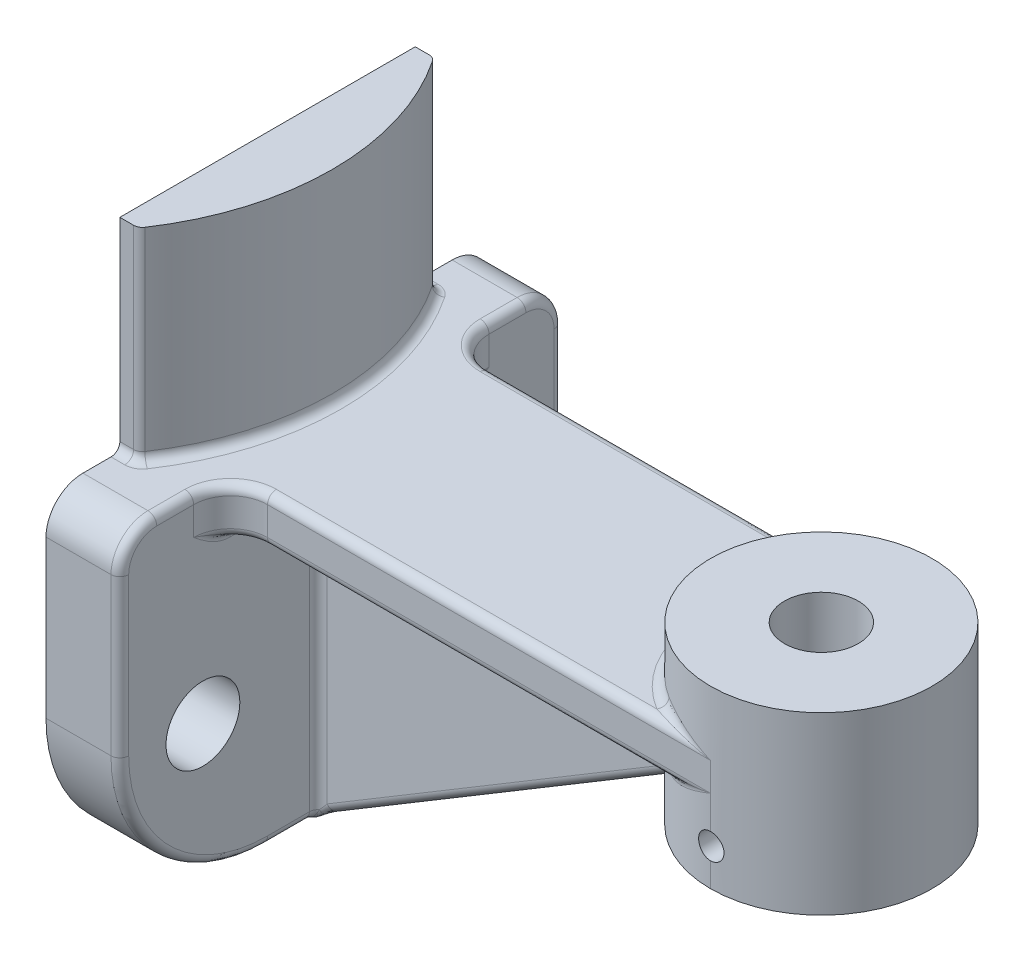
SolidWorks part; units mm, degrees
ref_plane "Front" through (0, 0, 0) normal (0, 0, 1) x (1, 0, 0)
ref_plane "Top" through (0, 0, 0) normal (0, 1, 0) x (1, 0, 0)
ref_plane "Right" through (0, 0, 0) normal (1, 0, 0) x (0, 0, -1)
sketch "Sketch1" plane through (0, 0, 0) normal (1, 0, 0) x (0, 0, -1)
  line L0 (0, 0) -> (76.2, 0)
  line L1 (0, 0) -> (0, 58.7375)
  line L2 (76.2, 58.7375) -> (0, 58.7375)
  line L3 (76.2, 58.7375) -> (76.2, 0)
  dimension "D1" = 76.2
  dimension "D2" = 58.7375
extrude "Base-Extrude" add sketch "Sketch1" along normal blind 12.7
sketch "Sketch2" plane through (12.7, 0, 0) normal (1, 0, 0) x (0, 0, -1)
  line L0 (19.05, 58.7375) -> (57.15, 58.7375)
  line L1 (19.05, 58.7375) -> (19.05, 50.8)
  line L2 (57.15, 50.8) -> (19.05, 50.8)
  line L3 (57.15, 50.8) -> (57.15, 58.7375)
  line L4 (76.2, 58.7375) -> (0, 58.7375) construction
  line L5 (38.1, 58.7375) -> (38.1, 0) construction
  line L6 (0, 0) -> (76.2, 0) construction
  dimension "D1" = 7.9375
  dimension "D2" = 38.1
extrude "Boss-Extrude3" add sketch "Sketch2" along normal offset from surface (82.55 mm away) 95.25
ref_plane "Plane4" through (0, 68.2625, 0) normal (0, 1, 0) x (-1, 0, 0)
sketch "Sketch4" plane through (0, 68.2625, 0) normal (0, 1, 0) x (-1, 0, 0)
  line L0 (-95.25, -57.15) -> (-95.25, -19.05) construction
  circle A0 centre (-95.25, -38.1) radius 19.05
extrude "Boss-Extrude4" add sketch "Sketch4" against normal blind 30.1625
sketch "Sketch5" plane through (0, 58.7375, 0) normal (0, 1, 0) x (-1, 0, 0)
  line L0 (0, -63.5) -> (-3.175, -63.5)
  line L1 (0, -63.5) -> (0, -12.7)
  line L2 (-3.175, -12.7) -> (0, -12.7)
  line L4 (0, -76.2) -> (0, 0) construction
  arc A0 (-3.175, -12.7) -> (-3.175, -63.5) centre (33.303, -38.1) ccw
  point P6 (0, -38.1)
  dimension "D3" = 44.45
  dimension "D1" = 50.8
  dimension "D2" = 3.175
extrude "Boss-Extrude5" add sketch "Sketch5" along normal blind 34.925
sketch "Sketch6" plane through (0, 0, 0) normal (1, 0, 0) x (0, 0, -1)
  line L0 (63.5, 93.6625) -> (12.7, 93.6625) construction
  line L1 (0, 0) -> (76.2, 0) construction
  point P0 (38.1, 93.6625)
  point P1 (38.1, 0)
sketch "Sketch7" plane through (0, 0, 0) normal (0, 1, 0) x (1, 0, 0)
  line L0 (12.7, 0) -> (12.7, 76.2) construction
  point P0 (12.7, 38.1)
ref_plane "Plane5" through (0, 0, -38.1) normal (0, 0, -1) x (-1, 0, 0)
sketch "Sketch8" plane through (0, 0, -38.1) normal (0, 0, -1) x (-1, 0, 0)
  line L0 (-12.7, 0) -> (-95.25, 49.53)
  line L2 (-12.7, 50.8) -> (-12.7, 0)
  line L3 (-95.25, 50.8) -> (-12.7, 50.8) construction
  line L4 (-95.25, 50.8) -> (-12.7, 50.8)
  line L5 (-95.25, 50.8) -> (-95.25, 49.53)
  line L6 (-95.25, 50.8) -> (-95.25, 58.7375) construction
  point P0 (-76.2, 38.1)
extrude "Boss-Extrude7" add sketch "Sketch8" along normal mid plane 7.9375
sketch "Sketch9" plane through (12.7, 0, 0) normal (1, 0, 0) x (0, 0, -1)
  line L0 (19.05, 58.7375) -> (0, 58.7375) construction
  line L1 (14.2875, 23.8125) -> (61.9125, 23.8125) construction
  line L2 (38.1, 23.8125) -> (38.1, 0) construction
  line L3 (42.0688, 0) -> (34.1313, 0) construction
  circle A0 centre (14.2875, 23.8125) radius 6.35
  circle A1 centre (61.9125, 23.8125) radius 6.35
  dimension "D1" = 12.7
  dimension "D2" = 34.925
  dimension "D3" = 47.625
extrude "Cut-Extrude1" cut sketch "Sketch9" against normal through all
sketch "Sketch10" plane through (0, 68.2625, 0) normal (0, 1, 0) x (-1, 0, 0)
  circle A0 centre (-95.25, -38.1) radius 6.35
  circle A1 centre (-95.25, -38.1) radius 19.05 construction
  dimension "D1" = 12.7
extrude "Cut-Extrude2" cut sketch "Sketch10" against normal through all
sketch "Sketch11" plane through (0, 0, -38.1) normal (0, 0, -1) x (-1, 0, 0)
  line L0 (-101.6, 38.1) -> (-88.9, 38.1) construction
  circle A0 centre (-95.25, 44.45) radius 2.1828
  dimension "D1" = 4.3656
  dimension "D2" = 6.35
extrude "Cut-Extrude3" cut sketch "Sketch11" against normal through all and the other way through all
fillet "Fillet1" radius 6.35 6 edges at (6.35, 58.7375, -76.2) (6.35, 58.7375, 0)
fillet "Fillet2" radius 25.4 2 edges at (6.35, 0, 0) (6.35, 0, -76.2)
fillet "Fillet4" radius 1.524 11 edges at (14.5599, 50.8, -17.1901) (14.5599, 50.8, -59.0099) (57.15, 50.8, -19.05) (57.15, 50.8, -57.15) (11.147, 58.7375, -38.1) (3.175, 76.2, -12.7) (3.175, 76.2, -63.5) (1.5875, 58.7375, -63.5) (1.5875, 58.7375, -12.7) (44.659, 50.8, -42.0688) (44.659, 50.8, -34.1313)
fillet "Fillet5" radius 1.524 14 edges at (14.5599, 58.7375, -17.1901) (14.5599, 58.7375, -59.0099) (12.7, 0, -29.7656) (12.7, 38.8937, 0) (12.7, 7.4395, -7.4395) (12.7, 7.4395, -68.7605) (12.7, 0, -46.4344) (12.7, 38.8937, -76.2) (12.7, 56.8776, -74.3401) (12.7, 56.8776, -1.8599)
fillet "Fillet6" radius 1.524 3 edges at (76.2, 58.7375, -38.1) (90.6843, 58.39, -19.6052) (90.6843, 58.39, -56.5948)
fillet "Fillet7" radius 1.524 12 edges at (12.7, 50.8, -24.9816) (12.7, 50.8, -51.2184) (12.7, 25.4, -42.0688) (12.7, 50.3536, -42.5151) (12.7, 25.4, -34.1313) (12.7, 50.3536, -33.6849) (12.7, 51.1454, -15.4195) (12.7, 51.1454, -60.7805) (11.938, 0, -42.0688) (11.938, 0, -34.1313) (12.2536, 0.4464, -34.1313) (12.2536, 0.4464, -42.0688)
fillet "Fillet10" radius 1.524 8 edges at (81.058, 50.8, -25.3921) (81.058, 50.8, -50.8079) (76.618, 43.8134, -42.0688) (76.618, 43.8134, -34.1313) (76.7434, 50.4471, -33.5825) (76.6891, 50.2107, -42.389) (90.6843, 51.1475, -19.6052) (90.6843, 51.1475, -56.5948)
fillet "Fillet11" radius 1.524 10 edges at (44.7881, 19.2529, -34.1313) (14.2063, 1.1961, -34.1313) (44.7881, 19.2529, -42.0688) (14.2063, 1.1961, -42.0688) (13.4267, 0.436, -34.0293) (11.6442, 0, -33.0648) (76.3454, 38.1872, -42.3798) (76.3454, 38.1872, -33.8202) (76.3737, 38.2042, -40.6663)
